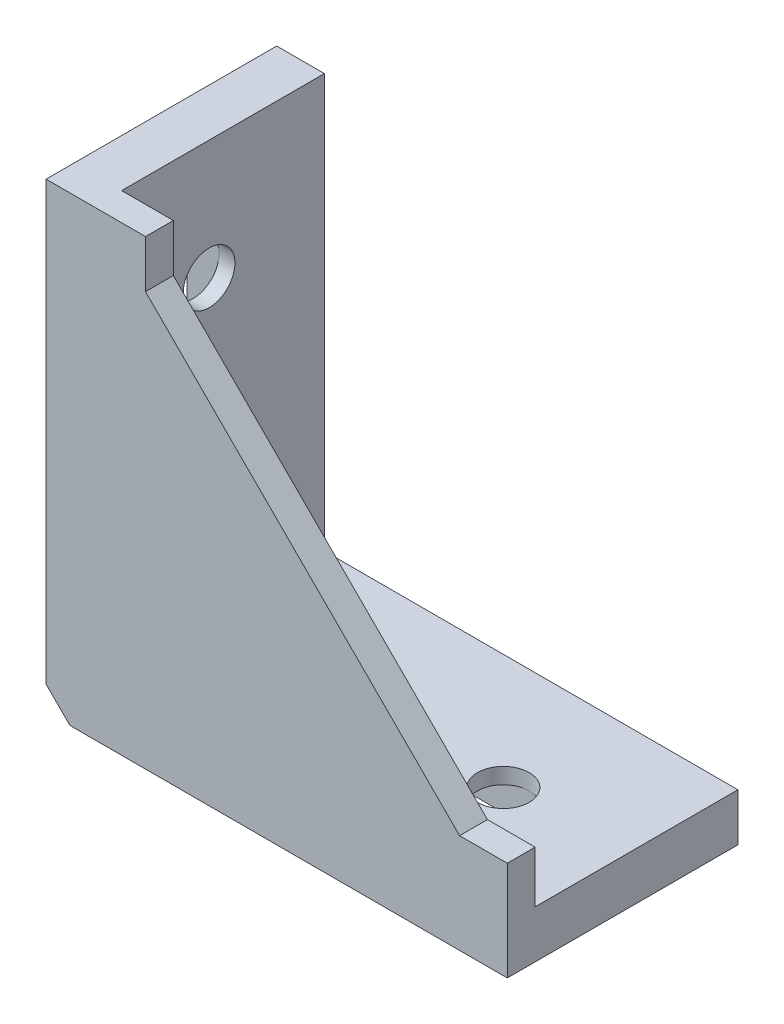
SolidWorks part; units mm, degrees
ref_plane "前视基准面" through (0, 0, 0) normal (0, 0, 1) x (1, 0, 0)
ref_plane "上视基准面" through (0, 0, 0) normal (0, 1, 0) x (1, 0, 0)
ref_plane "右视基准面" through (0, 0, 0) normal (1, 0, 0) x (0, 0, -1)
sketch "草图1" plane through (0, 0, 0) normal (0, 0, 1) x (1, 0, 0)
  line L0 (-42.3884, 57.4837) -> (-36.3884, 57.4837)
  line L1 (-36.3884, 57.4837) -> (-36.3884, 5.4837)
  line L2 (-36.3884, 5.4837) -> (15.6116, 5.4837)
  line L3 (15.6116, 5.4837) -> (15.6116, -0.5163)
  line L4 (15.6116, -0.5163) -> (-42.3884, -0.5163)
  line L5 (-42.3884, -0.5163) -> (-42.3884, 57.4837)
  dimension "D1" = 6
  dimension "D2" = 58
  dimension "D3" = 58
  dimension "D4" = 52
  dimension "D5" = 52
extrude "凸台-拉伸1" add sketch "草图1" along normal blind 29
sketch "草图2" plane through (0, 0, 29) normal (0, 0, 1) x (1, 0, 0)
  line L0 (-36.3884, 57.4837) -> (-29.8884, 57.4837)
  line L1 (-29.8884, 57.4837) -> (-29.8884, 51.4837)
  line L2 (-29.8884, 51.4837) -> (9.6116, 11.9837)
  line L3 (15.6116, 5.4837) -> (15.6116, 11.9837)
  line L4 (15.6116, 11.9837) -> (9.6116, 11.9837)
  line L5 (-36.3884, 57.4837) -> (-36.3884, 5.4837)
  line L6 (-36.3884, 5.4837) -> (15.6116, 5.4837)
  dimension "D1" = 6.5
  dimension "D2" = 6.5
  dimension "D3" = 6
  dimension "D4" = 6
extrude "凸台-拉伸2" add sketch "草图2" against normal blind 3.5
sketch "草图3" plane through (-42.3884, 0, 0) normal (-1, 0, 0) x (0, 0, 1)
  line L0 (14.5, 57.4837) -> (14.5, -0.5163)
  line L1 (29, 57.4837) -> (0, 57.4837) construction
  line L2 (29, -0.5163) -> (0, -0.5163) construction
  line L3 (14.5, 26.4837) -> (14.5, 14.4837) construction
  line L4 (17.75, 26.4837) -> (17.75, 14.4837)
  line L5 (11.25, 26.4837) -> (11.25, 14.4837)
  circle A0 centre (14.5, 42.4837) radius 3.25
  arc A1 (17.75, 26.4837) -> (11.25, 26.4837) centre (14.5, 26.4837) ccw
  arc A2 (11.25, 14.4837) -> (17.75, 14.4837) centre (14.5, 14.4837) ccw
  point P10 (14.5, 20.4837)
  dimension "D1" = 12
  dimension "D4" = 6.5
  dimension "D5" = 3.25
  dimension "D2" = 15
  dimension "D3" = 15
extrude "切除-拉伸1" cut sketch "草图3" against normal through all contours L0 A2 L4 A1 | L0 A0 | L0 A0 | L5 A2 L0 A1
sketch "草图4" plane through (-42.3884, 0, 0) normal (-1, 0, 0) x (0, 0, 1)
  line L0 (3.5, 53.6602) -> (7.5, 53.6602)
  line L1 (7.5, 53.6602) -> (7.5, 6.4837)
  line L2 (7.5, 6.4837) -> (3.5, 6.4837)
  line L3 (3.5, 6.4837) -> (3.5, 53.6602)
  line L4 (21.5, 53.6602) -> (25.5, 53.6602)
  line L5 (25.5, 53.6602) -> (25.5, 5.8807)
  line L6 (25.5, 5.8807) -> (21.5, 5.8807)
  line L7 (21.5, 5.8807) -> (21.5, 53.6602)
  line L8 (11.25, 42.4837) -> (11.25, 50.4837)
  line L9 (11.25, 50.4837) -> (17.75, 50.4837)
  line L10 (17.75, 50.4837) -> (17.75, 6.4837)
  line L11 (17.75, 6.4837) -> (11.25, 6.4837)
  line L12 (11.25, 6.4837) -> (11.25, 50.4837)
  line L13 (0, 57.4837) -> (0, -0.5163) construction
  line L14 (29, 57.4837) -> (29, -0.5163) construction
  line L15 (29, 57.4837) -> (0, 57.4837) construction
  circle A1 centre (14.5, 42.4837) radius 3.25 construction
  point P23 (-17.3465, 65.2735)
  point P24 (9.5306, 50.5382)
  dimension "D1" = 3.5
  dimension "D2" = 3.5
  dimension "D3" = 4
  dimension "D4" = 3.75
  dimension "D5" = 6.5
  dimension "D6" = 44
  dimension "D7" = 7
  dimension "D8" = 3.75
extrude "切除-拉伸2" cut sketch "草图4" against normal blind 4 contours L3 L2 L1 L0 | L12 L10 M2 M5 | L10 L9 L8 M5 | L7 L6 L5 L4 | L12 L11 L10 M4
ref_plane "基准面1" through (-20.9361, 20.9361, 0) normal (0.7071, -0.7071, 0) x (0, 0, -1)
mirror "镜向1" about plane through (-20.9361, 20.9361, 0) normal (0.7071, -0.7071, 0) of "切除-拉伸2", "切除-拉伸1"
sketch "草图5" plane through (-42.3884, 0, 0) normal (-1, 0, 0) x (0, 0, 1)
  line L0 (12, 6.4837) -> (12, 4.4837)
  line L1 (17.75, 6.4837) -> (11.25, 6.4837) construction
  line L2 (12, 4.4837) -> (17, 4.4837)
  line L3 (17, 4.4837) -> (17, 6.4837)
  line L4 (17, 6.4837) -> (12, 6.4837)
  line L5 (17, 50.4837) -> (17, 52.4837)
  line L6 (11.25, 50.4837) -> (17.75, 50.4837) construction
  line L7 (17, 52.4837) -> (12, 52.4837)
  line L8 (12, 52.4837) -> (12, 50.4837)
  line L9 (12, 50.4837) -> (17, 50.4837)
  line L10 (0, 57.4837) -> (0, -0.5163) construction
  dimension "D1" = 5
  dimension "D2" = 5
  dimension "D3" = 2
  dimension "D4" = 2
  dimension "D5" = 12
  dimension "D6" = 12
extrude "凸台-拉伸3" add sketch "草图5" along normal blind 2
mirror "镜向2" about plane through (-20.9361, 20.9361, 0) normal (0.7071, -0.7071, 0) of "凸台-拉伸3"
chamfer "倒角1" distance 3 angle 45 1 edges at (-42.3884, -0.5163, 14.5)
